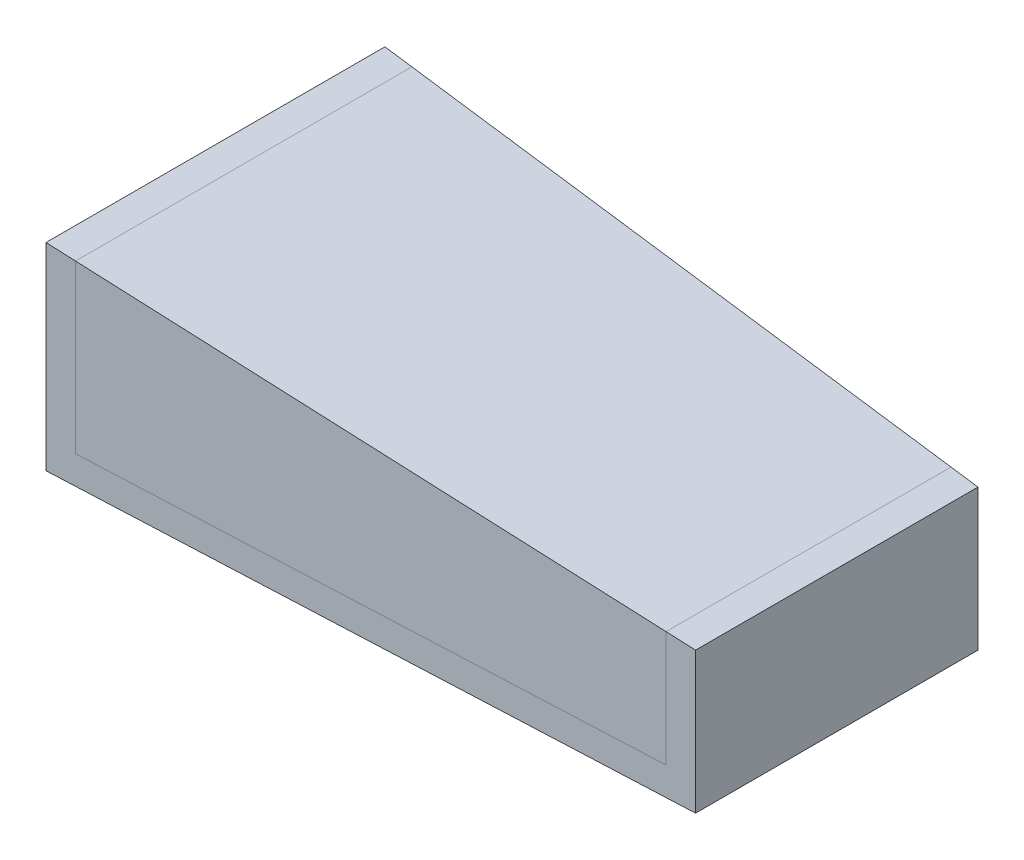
SolidWorks part; units mm, degrees
ref_plane "Front Plane" through (0, 0, 0) normal (0, 0, 1) x (1, 0, 0)
ref_plane "Top Plane" through (0, 0, 0) normal (0, 1, 0) x (1, 0, 0)
ref_plane "Right Plane" through (0, 0, 0) normal (1, 0, 0) x (0, 0, -1)
sketch "Sketch1" plane through (0, 0, 0) normal (0, 0, 1) x (1, 0, 0)
  line L0 (0, 0) -> (220, 0)
  line L1 (220, 50) -> (220, 0)
  line L2 (0, 70) -> (0, 0)
  line L3 (0, 70) -> (220, 50)
  dimension "D1" = 220
  dimension "D2" = 70
  dimension "D3" = 50
extrude "Boss-Extrude1" add sketch "Sketch1" along normal mid plane 120
sketch "Sketch2" plane through (0, 0, 0) normal (0, -1, 0) x (-1, 0, 0)
  line L0 (0, -60) -> (-220, -60)
  line L1 (-220, -60) -> (-220, -50)
  line L2 (-220, -60) -> (-220, 60) construction
  line L3 (0, -60) -> (-220, -50)
  dimension "D1" = 10
extrude "Cut-Extrude1" cut sketch "Sketch2" against normal blind 120
ref_plane "Plane1" through (0, 0, 0) normal (0, 0, -1) x (-1, 0, 0)
mirror "Mirror1" about plane through (0, 0, 0) normal (0, 0, -1) of "Cut-Extrude1"
sketch "Sketch3" plane through (0, 0, 0) normal (0, 0, -1) x (-1, 0, 0)
  line L0 (0, 70) -> (0, 0) construction
  line L1 (-10, 96.0286) -> (-210, 96.0286)
  line L2 (-10, 96.0286) -> (-10, 10)
  line L3 (-10, 10) -> (-210, 10)
  line L4 (-210, 96.0286) -> (-210, 10)
  line L5 (0, 0) -> (-220, 0) construction
  line L6 (-220, 50) -> (-220, 0) construction
  dimension "D1" = 10
  dimension "D2" = 10
  dimension "D3" = 10
split "Split1" trim tools "Sketch3" bodies to split 103 resulting bodies 104 105
